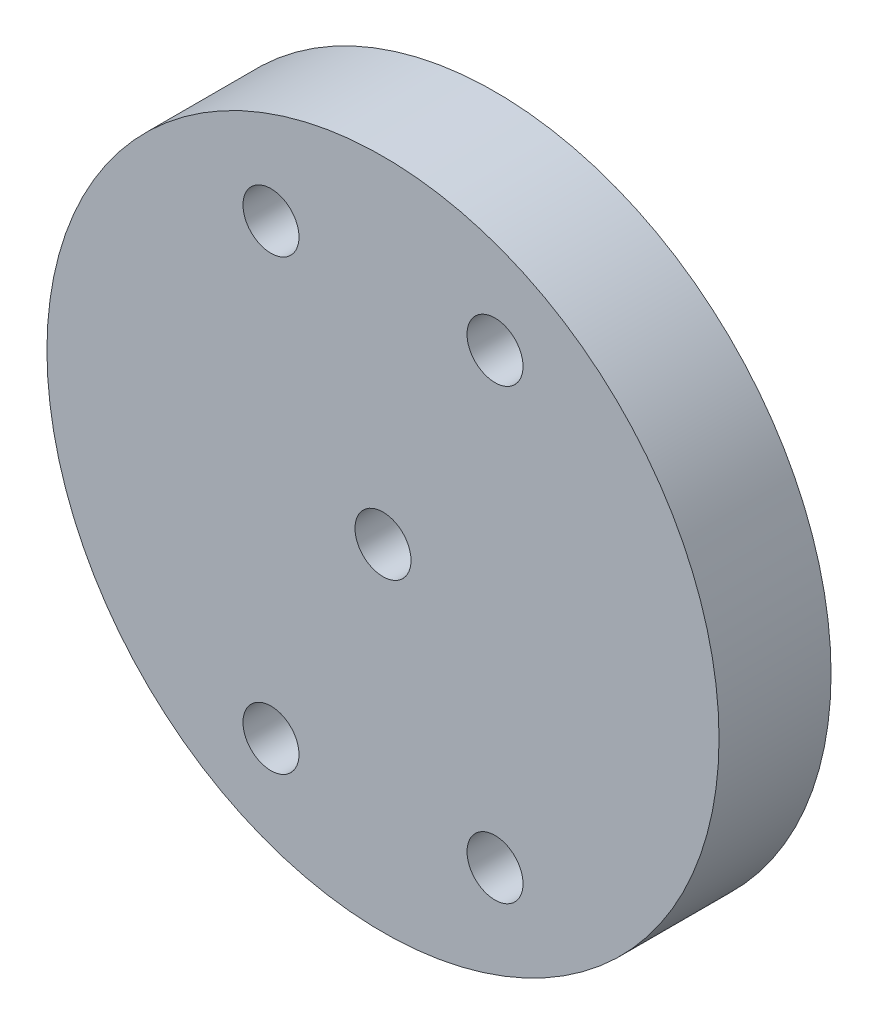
SolidWorks part; units mm, degrees
ref_plane "Front Plane" through (0, 0, 0) normal (0, 0, 1) x (1, 0, 0)
ref_plane "Top Plane" through (0, 0, 0) normal (0, 1, 0) x (1, 0, 0)
ref_plane "Right Plane" through (0, 0, 0) normal (1, 0, 0) x (0, 0, -1)
sketch "Sketch1" plane through (0, 0, 0) normal (0, 0, 1) x (1, 0, 0)
  circle A0 centre (0, 0) radius 38.1
  dimension "D1" = 76.2
extrude "Boss-Extrude1" add sketch "Sketch1" along normal blind 12.7
sketch "Sketch2" plane through (0, 0, 12.7) normal (0, 0, 1) x (1, 0, 0)
  line L0 (0, -25.4) -> (0, 25.4) construction
  line L1 (-12.7, 25.4) -> (12.7, 25.4) construction
  line L2 (0, 0) -> (16.6523, 0) construction
  line L3 (-12.7, -25.4) -> (12.7, -25.4) construction
  dimension "D1" = 25.4
  dimension "D2" = 12.7
hole_wizard "1/4-20 Tapped Hole1" positions "Sketch4" profile "Sketch3" tap size "1/4-20" standard "ANSI Inch"
sketch "Sketch4" plane through (0, 0, 12.7) normal (0, 0, 1) x (1, 0, 0)
  point P0 (12.7, 25.4)
  point P3 (-12.7, 25.4)
  point P6 (-12.7, -25.4)
  point P9 (12.7, -25.4)
  point P12 (0, 0)
sketch "Sketch3" plane through (12.7, 25.4, 12.7) normal (1, 0, 0) x (0, -1, 0)
  line L0 (0, 0) -> (0, 12.7)
  line L1 (0, 12.7) -> (3.175, 12.7)
  line L2 (3.175, 12.7) -> (3.175, 0)
  line L5 (3.175, 0) -> (0, 0)
  line L11 (0, -6.35) -> (0, 107.95) construction
  dimension "Thread Major Dia." = 6.35
  dimension "Thru Tap Drill Depth" = 12.7
